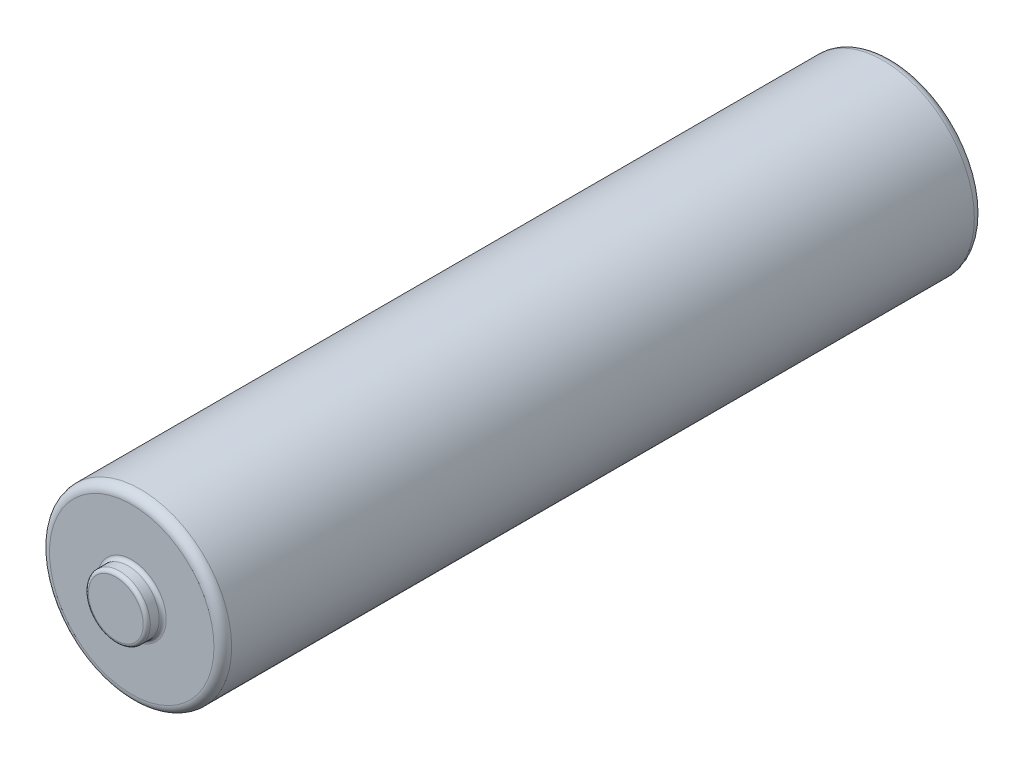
SolidWorks part; units mm, degrees
ref_plane "Plan de face" through (0, 0, 0) normal (0, 0, 1) x (1, 0, 0)
ref_plane "Plan de dessus" through (0, 0, 0) normal (0, 1, 0) x (1, 0, 0)
ref_plane "Plan de droite" through (0, 0, 0) normal (1, 0, 0) x (0, 0, -1)
sketch "Esquisse1" plane through (0, 0, 0) normal (0, 0, 1) x (1, 0, 0)
  circle A0 centre (0, 0) radius 5.15
  dimension "D1" = 10.3
extrude "Extrusion1" add sketch "Esquisse1" along normal blind 43
sketch "Esquisse2" plane through (0, 0, 43) normal (0, 0, 1) x (1, 0, 0)
  circle A0 centre (0, 0) radius 1.75
  dimension "D1" = 3.5
extrude "Extrusion2" add sketch "Esquisse2" along normal blind 0.9
fillet "Congé1" radius 0.2 2 edges at (1.75, 0, 43) (1.75, 0, 43.9)
fillet "Congé2" radius 0.5 2 edges at (5.15, 0, 0) (5.15, 0, 43)
sketch "Esquisse3" plane through (0, 0, 0) normal (0, 0, -1) x (-1, 0, 0)
  circle A0 centre (0, 0) radius 4
  circle A1 centre (0, 0) radius 3
extrude "Enlèv. mat.-Extru.1" cut sketch "Esquisse3" against normal blind 0.1
fillet "Congé3" radius 0.05 2 edges at (-4, 0, 0.1) (-3, 0, 0.1)
